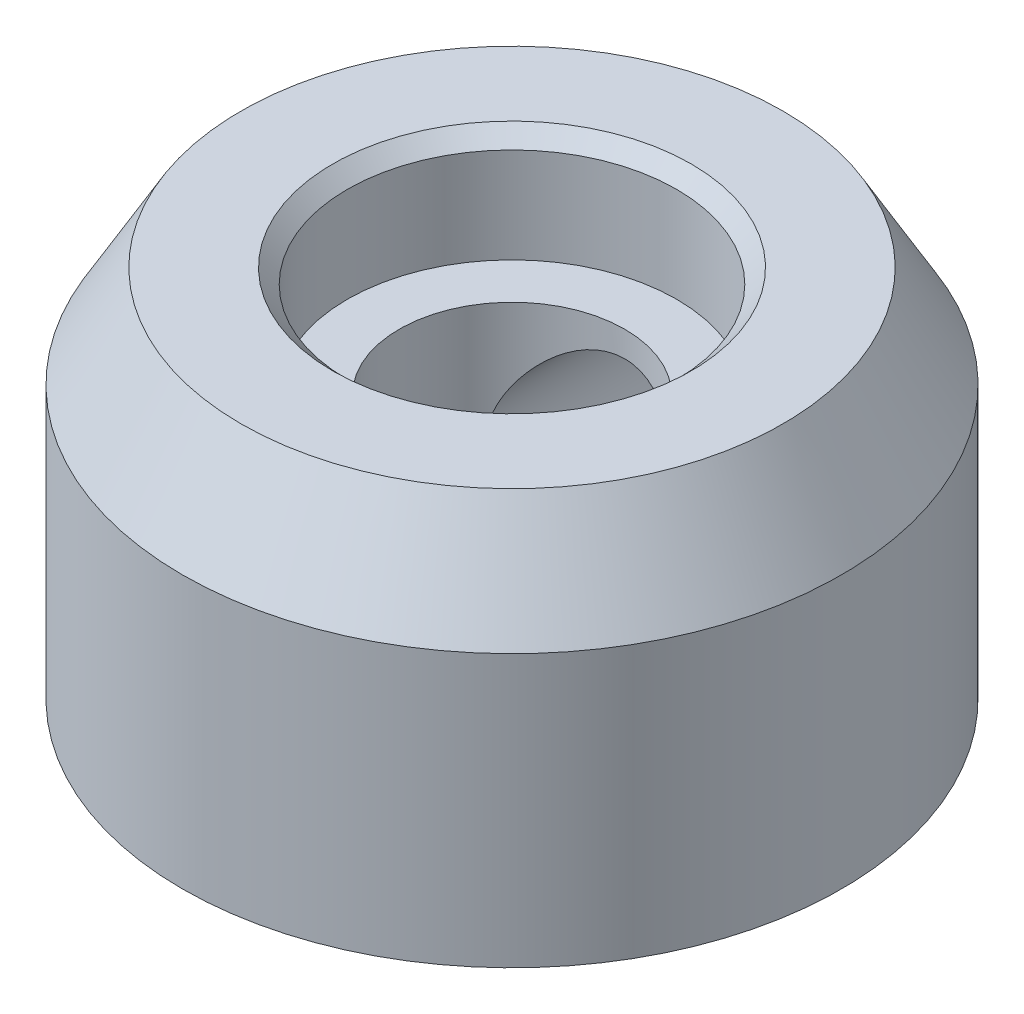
SolidWorks part; units mm, degrees
ref_plane "Front Plane" through (0, 0, 0) normal (0, 0, 1) x (1, 0, 0)
ref_plane "Top Plane" through (0, 0, 0) normal (0, 1, 0) x (1, 0, 0)
ref_plane "Right Plane" through (0, 0, 0) normal (1, 0, 0) x (0, 0, -1)
sketch "Sketch2" plane through (0, 0, 0) normal (0, 0, 1) x (1, 0, 0)
  line L0 (14.2875, 17.4625) -> (7.1374, 17.4625)
  line L1 (0, 0) -> (0, 19.0927) construction
  line L2 (14.2875, 17.4625) -> (14.2875, 1.27)
  line L3 (4.8895, 0) -> (6.2103, 0)
  line L4 (6.2103, 0) -> (6.2103, 1.27)
  line L5 (6.2103, 1.27) -> (8.3947, 1.27)
  line L6 (8.3947, 1.27) -> (8.3947, 0)
  line L7 (8.3947, 0) -> (11.1633, 0)
  line L8 (7.1374, 17.4625) -> (7.1374, 12.7)
  line L9 (4.8895, 0) -> (4.8895, 12.7)
  line L10 (4.8895, 12.7) -> (7.1374, 12.7)
  line L11 (11.1633, 0) -> (11.1633, 1.27)
  line L12 (11.1633, 1.27) -> (14.2875, 1.27)
  dimension "D1" = 4.8895
  dimension "D2" = 8.3947
  dimension "D3" = 14.2875
  dimension "D4" = 6.2103
  dimension "D5" = 1.27
  dimension "D6" = 14.2748
  dimension "D7" = 4.7625
revolve "Revolve1" add sketch "Sketch2" angle 360 about L1
sketch "Sketch3" plane through (0, 0, 0) normal (0, 0, 1) x (1, 0, 0)
  circle A0 centre (0, 7.62) radius 3.9688
extrude "Cut-Extrude1" cut sketch "Sketch3" against normal through all
chamfer "Chamfer1" distance 0.635 angle 45 1 edges at (0, 17.4625, -7.1374)
chamfer "Chamfer2" distance 2.54 angle 60 1 edges at (0, 17.4625, -14.2875)
